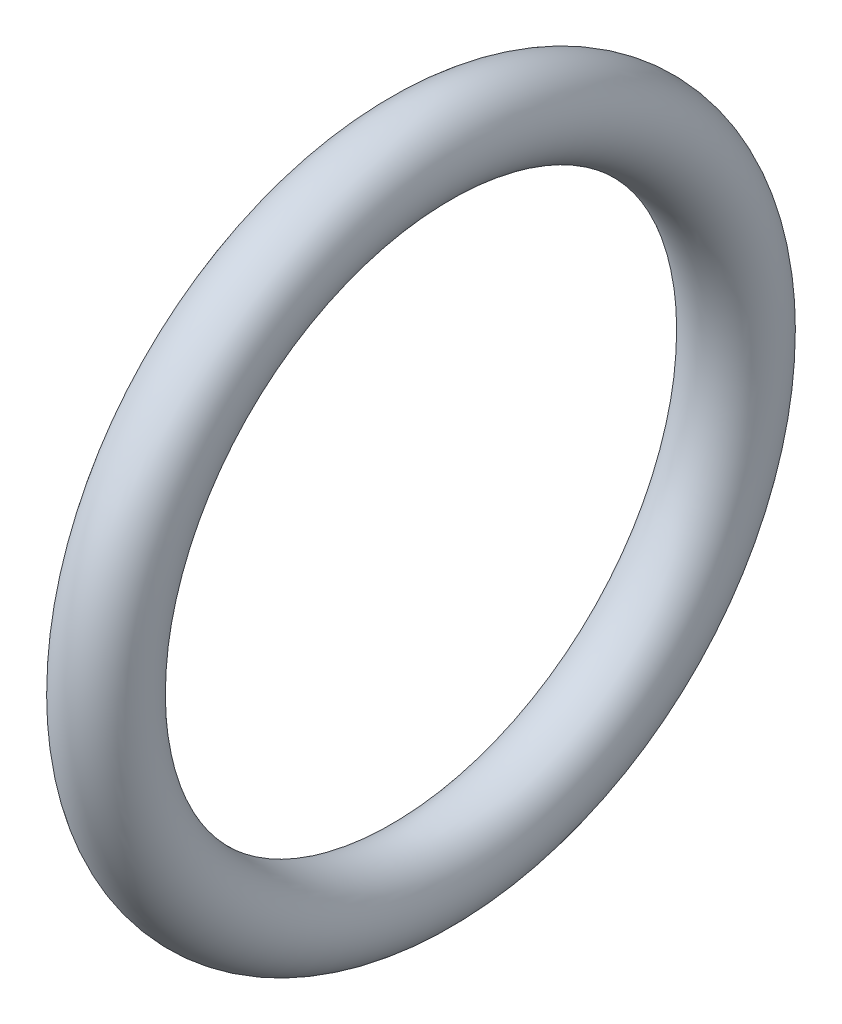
SolidWorks part; units mm, degrees
ref_plane "Plan de face" through (0, 0, 0) normal (0, 0, 1) x (1, 0, 0)
ref_plane "Plan de dessus" through (0, 0, 0) normal (0, 1, 0) x (1, 0, 0)
ref_plane "Plan de droite" through (0, 0, 0) normal (1, 0, 0) x (0, 0, -1)
sketch "Esquisse1" plane through (0, 0, 0) normal (0, 0, 1) x (1, 0, 0)
  line L4 (-29.1481, -1.3195) -> (-23.7399, -1.3195) construction
  circle A0 centre (-26.1354, 6.1805) radius 1
  dimension "D1" = 2
  dimension "D3" = 7.5
revolve "Révolution1" add sketch "Esquisse1" angle 360 about L4
